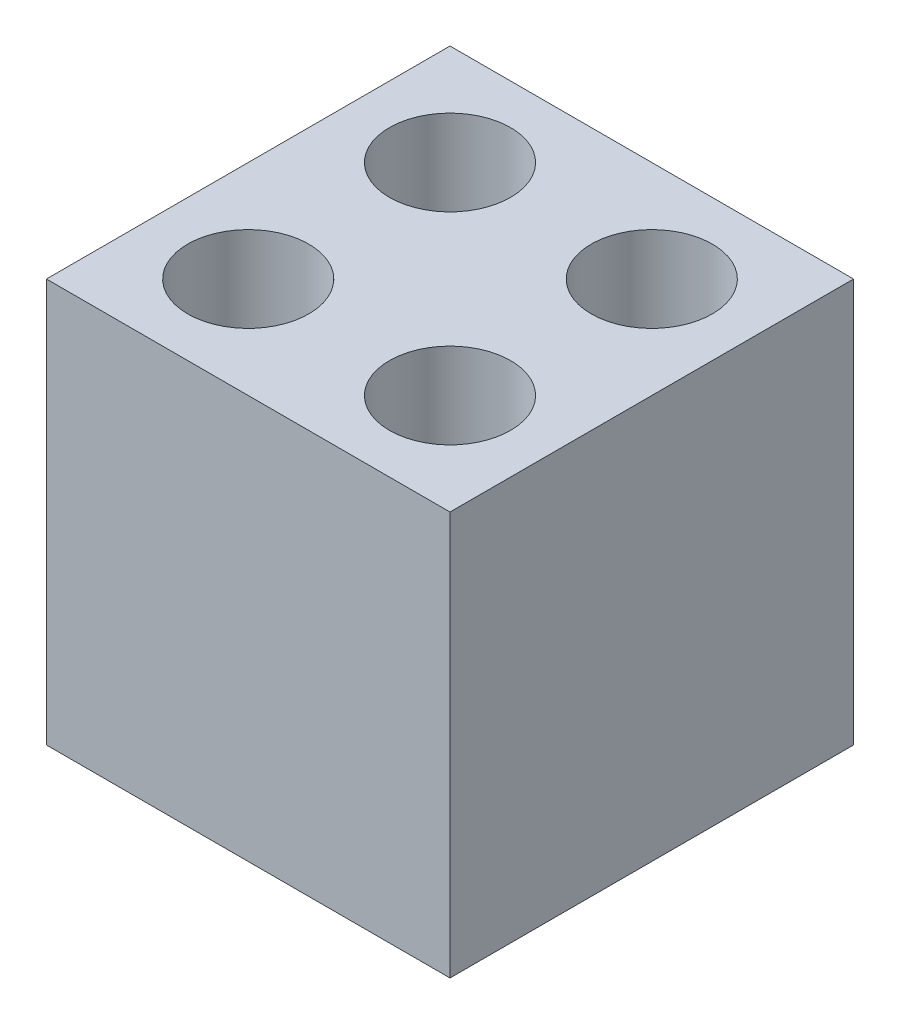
SolidWorks part; units mm, degrees
ref_plane "Front Plane" through (0, 0, 0) normal (0, 0, 1) x (1, 0, 0)
ref_plane "Top Plane" through (0, 0, 0) normal (0, 1, 0) x (1, 0, 0)
ref_plane "Right Plane" through (0, 0, 0) normal (1, 0, 0) x (0, 0, -1)
sketch "Sketch1" plane through (0, 0, 0) normal (0, 0, 1) x (1, 0, 0)
  line L1 (-10, -10) -> (10, -10)
  line L2 (-10, -10) -> (-10, 10)
  line L3 (-10, 10) -> (10, 10)
  line L4 (10, -10) -> (10, 10)
  line L5 (-10, -10) -> (10, 10) construction
  line L6 (-10, 10) -> (10, -10) construction
  point P0 (0, 0)
  dimension "D1" = 20
  dimension "D2" = 20
extrude "Boss-Extrude1" add sketch "Sketch1" along normal mid plane 20 contours L1 L4 L3 L2
hole_wizard "M7x1.0 Tapped Hole1" positions "Sketch2" profile "Sketch3" tap size "M7x1.0" standard "ANSI Metric"
sketch "Sketch2" plane through (0, 10, 0) normal (0, 1, 0) x (1, 0, 0)
  line L0 (-10, 10) -> (10, 10) construction
  line L1 (-10, -10) -> (10, -10) construction
  line L2 (-10, -10) -> (-10, 10) construction
  point P0 (-5, 5)
  point P2 (-5, -5)
  dimension "D1" = 5
  dimension "D2" = 5
  dimension "D3" = 5
sketch "Sketch3" plane through (-5, 10, -5) normal (1, 0, 0) x (0, 0, 1)
  line L0 (0, 0) -> (0, 20)
  line L1 (0, 20) -> (3, 20)
  line L2 (3, 20) -> (3, 0)
  line L5 (3, 0) -> (0, 0)
  line L11 (0, -6.35) -> (0, 107.95) construction
  dimension "Thru Tap Drill Dia." = 6
  dimension "Thru Tap Drill Depth" = 20
hole_wizard "M7x1.0 Tapped Hole2" positions "Sketch4" profile "Sketch5" tap size "M7x1.0" standard "ANSI Metric"
sketch "Sketch4" plane through (0, 10, 0) normal (0, 1, 0) x (1, 0, 0)
  line L0 (-10, 10) -> (10, 10) construction
  line L1 (-10, -10) -> (10, -10) construction
  line L2 (10, -10) -> (10, 10) construction
  point P0 (5, 5)
  point P2 (5, -5)
  dimension "D1" = 5
  dimension "D2" = 5
  dimension "D3" = 5
sketch "Sketch5" plane through (5, 10, -5) normal (1, 0, 0) x (0, 0, 1)
  line L0 (0, 0) -> (0, 20)
  line L1 (0, 20) -> (3, 20)
  line L2 (3, 20) -> (3, 0)
  line L5 (3, 0) -> (0, 0)
  line L11 (0, -6.35) -> (0, 107.95) construction
  dimension "Thread Major Dia." = 6
  dimension "Thru Tap Drill Depth" = 20
